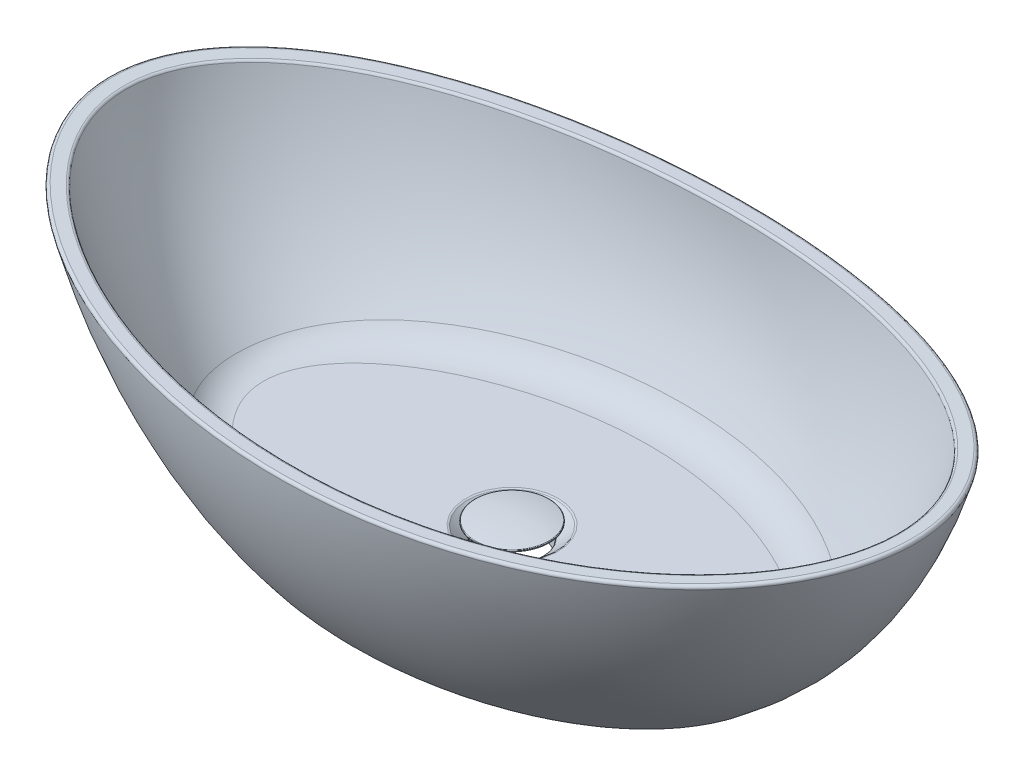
SolidWorks part; units mm, degrees
ref_plane "Płaszczyzna przednia" through (0, 0, 0) normal (0, 0, 1) x (1, 0, 0)
ref_plane "Płaszczyzna górna" through (0, 0, 0) normal (0, 1, 0) x (1, 0, 0)
ref_plane "Płaszczyzna prawa" through (0, 0, 0) normal (1, 0, 0) x (0, 0, -1)
sketch "Szkic1" plane through (0, 0, 0) normal (0, 1, 0) x (1, 0, 0)
  line L1 (-300, -175) -> (300, -175)
  line L2 (-300, -175) -> (-300, 175)
  line L3 (-300, 175) -> (300, 175)
  line L4 (300, -175) -> (300, 175)
  line L5 (-300, -175) -> (300, 175) construction
  line L6 (-300, 175) -> (300, -175) construction
  point P0 (0, 0)
  dimension "D1" = 600
  dimension "D2" = 350
sketch "Szkic4" plane through (0, 0, 0) normal (0, 1, 0) x (1, 0, 0)
  line L0 (-300, -175) -> (300, 175) construction
  line L1 (300, -175) -> (300, 175) construction
  line L2 (-300, 175) -> (300, 175) construction
  ellipse E0 centre (0, 0) end of major axis (300, 0) minor radius 175
sketch "Szkic2" plane through (0, 0, 0) normal (0, 1, 0) x (1, 0, 0)
  line L0 (300, 0) -> (-300, 0) construction
  line L1 (300, -175) -> (300, 175) construction
  line L2 (-300, -175) -> (-300, 175) construction
  line L3 (0, 175) -> (0, -175) construction
  line L4 (-300, 175) -> (300, 175) construction
  line L5 (-300, -175) -> (300, -175) construction
  arc A0 (-170, 148.5729) -> (170, 148.5729) centre (0, -385) cw
  arc A1 (-170, -148.5729) -> (170, -148.5729) centre (0, 385) ccw
  spline S0 degree 3 poles (-170, 148.5729) (-270.2441, 116.6344) (-329.7559, 0) (-270.2441, -116.6344) (-170, -148.5729) knots 0 0 0 0 0.5 1 1 1 1
  spline S1 degree 3 poles (170, 148.5729) (270.2441, 116.6344) (329.7559, 0) (270.2441, -116.6344) (170, -148.5729) knots 0 0 0 0 0.5 1 1 1 1
  dimension "D1" = 560
  dimension "D2" = 340
sketch "Szkic5" plane through (0, 0, 0) normal (0, 0, 1) x (1, 0, 0)
  line L0 (0, 0) -> (0, -160) construction
  line L1 (190, -160) -> (-190, -160)
  arc A0 (-300, 0) -> (300, 0) centre (0, 2240) ccw
  arc A1 (300, 0) -> (190, -160) centre (11.0896, 80.8134) cw
  arc A2 (-300, 0) -> (-190, -160) centre (-11.0896, 80.8134) ccw
  point P8 (0, -20)
  dimension "D3" = 300
  dimension "D1" = 160
  dimension "D2" = 140
  dimension "D4" = 380
sketch "Szkic7" plane through (0, 0, 0) normal (0, 0, 1) x (1, 0, 0)
  arc A0 (-300, 0) -> (300, 0) centre (0, 2240) ccw construction
  arc A1 (-406.5511, 16.8679) -> (409.6417, 17.4353) centre (0, 2240) ccw
surface "Powierzchnia-Wyciągnięcie1" sketch "Szkic7" parameters "D1"=200, "D2"=200
surface "Powierzchnia-Przytnij1"
sketch "Szkic8" plane through (0, 0, 0) normal (1, 0, 0) x (0, 0, -1)
  line L0 (-175, -20) -> (175, -20)
  line L1 (-175, -20) -> (175, -20) construction
  line L2 (0, 0) -> (0, -160) construction
  line L3 (0, 0) -> (0, -160) construction
  line L4 (0, 0) -> (0, -160) construction
  line L5 (0, -160) -> (117.5, -160) construction
  arc A0 (175, -20) -> (117.5, -160) centre (-74.1561, 0.5239) cw
  arc A1 (-175, -20) -> (-117.5, -160) centre (74.1561, 0.5239) ccw
  dimension "D1" = 250
  dimension "D2" = 235
ref_plane "Płaszczyzna1" through (0, -160, 0) normal (0, 1, 0) x (-1, 0, 0)
sketch "Szkic9" plane through (0, -160, 0) normal (0, 1, 0) x (-1, 0, 0)
  line L0 (190, 0) -> (-190, 0) construction
  line L1 (0, 117.5) -> (0, -117.5) construction
  line L2 (-190, 63.6904) -> (-190, -63.6904) construction
  arc A0 (-110, 99.765) -> (110, 99.765) centre (0, -232.5) cw construction
  arc A2 (-110, -99.765) -> (110, -99.765) centre (0, 232.5) ccw construction
  ellipse E0 centre (0, 0) end of major axis (190, 0) minor radius 117.5
  spline S0 degree 3 poles (-110, 99.765) (-165.0063, 81.5545) (-214.9937, 0) (-165.0063, -81.5545) (-110, -99.765) knots 0 0 0 0 0.5 1 1 1 1 construction
  spline S1 degree 3 poles (110, 99.765) (165.0063, 81.5545) (214.9937, 0) (165.0063, -81.5545) (110, -99.765) knots 0 0 0 0 0.5 1 1 1 1 construction
  dimension "D1" = 350
  dimension "D2" = 220
surface "Powierzchnia-Wyciągnięcie po profilach1"
surface "Powierzchnia-Odsunięcie1" parameters "D1"=12
sketch "Szkic10" plane through (0, 0, 0) normal (0, 0, 1) x (1, 0, 0)
  line L0 (0, 0) -> (0, -160) construction
  line L1 (192.5069, -160) -> (-192.5069, -160) construction
  line L2 (-22.5, -160) -> (-22.7884, -148.9881)
  line L3 (-22.7884, -148.9881) -> (-33.5, -140)
  line L4 (-33.5, -140) -> (-370.815, -140)
  dimension "D1" = 90
  dimension "D2" = 50
  dimension "D3" = 67
  dimension "D4" = 1.5
  dimension "D5" = 45
  dimension "D6" = 20
surface "Powierzchnia-Obrót1" sketch "Szkic10" parameters "D1"=360
surface "Powierzchnia-Przytnij3"
surface "Powierzchnia-Płaszczyzna1"
surface "Powierzchnia-Przytnij4"
surface "Powierzchnia-Połącz2"
fillet "Zaokrąglenie1" radius 30 1 edges at (8.3417, -140, 117.8103)
fillet "Zaokrąglenie2" radius 2 5 edges at (-39.8954, -19.6478, 161.3501) (0, -148.9881, -22.7884) (0, -140, -33.5)
sketch "Szkic11" plane through (0, 0, 0) normal (0, 0, 1) x (1, 0, 0)
  line L0 (0, 0) -> (0, -160) construction
  line L1 (0, -138) -> (27.5, -138)
  line L2 (27.5, -138) -> (27.5, -137)
  line L3 (0, -134) -> (-16.606, -134) construction
  line L4 (0, -138) -> (0, -134)
  line L5 (-22.5, -160) -> (22.5, -160) construction
  arc A0 (0, -134) -> (27.5, -137) centre (0, -261.5417) cw
  dimension "D1" = 4
  dimension "D2" = 1
  dimension "D3" = 22
  dimension "D4" = 55
revolve "Obrót1" add sketch "Szkic11" angle 360 about L0
fillet "Zaokrąglenie3" radius 0.5 1 edges at (0, -137, 27.5)
